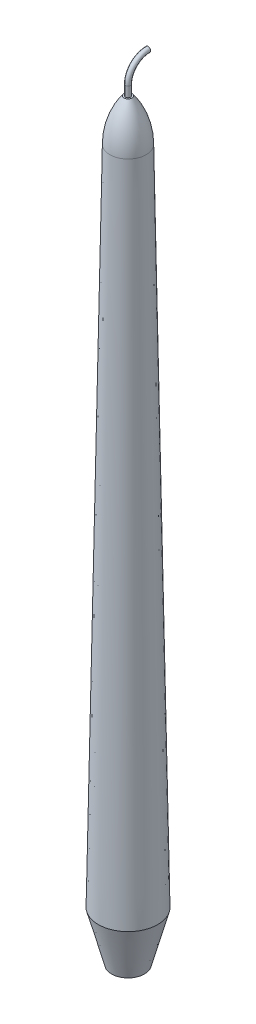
SolidWorks part; units mm, degrees
ref_plane "Plane1" through (0, 0, 0) normal (0, 0, 1) x (1, 0, 0)
ref_plane "Plane2" through (0, 0, 0) normal (0, 1, 0) x (1, 0, 0)
ref_plane "Plane3" through (0, 0, 0) normal (1, 0, 0) x (0, 0, -1)
sketch "Sketch1" plane through (0, 0, 0) normal (0, 0, 1) x (1, 0, 0)
  line L0 (15, 25) -> (8.3013, 0)
  line L1 (15, 25) -> (9.174, 358.7699)
  line L2 (0, 380) -> (2, 380)
  line L3 (0, -16.5815) -> (0, 380) construction
  line L4 (0, 0) -> (0, 380)
  line L5 (0, -50) -> (0, 50) construction
  line L7 (8.3013, 0) -> (0, 0)
  arc A0 (9.174, 358.7699) -> (2, 380) centre (-25.826, 358.7699) ccw
  dimension "D3" = 35
  dimension "D2" = 25
  dimension "D4" = 4
  dimension "D5" = 30
  dimension "D1" = 1
  dimension "Length" = 380
  dimension "D7" = 15
revolve "stick" add sketch "Sketch1" angle 360 about L3
sketch "path" plane through (0, 0, 0) normal (1, 0, 0) x (0, 0, -1)
  line L4 (0, 380) -> (0, 385.08)
  line L7 (2, 380) -> (-2, 380) construction
  arc A0 (0, 385.08) -> (10.16, 395.24) centre (10.16, 385.08) cw
  dimension "D1" = 10.16
  dimension "D2" = 5.08
sketch "section" plane through (0, 380, 0) normal (0, 1, 0) x (-1, 0, 0)
  circle A0 centre (0, 0) radius 1.27
  dimension "D1" = 2.54
sweep "wick" add profiles "section" path "path"
